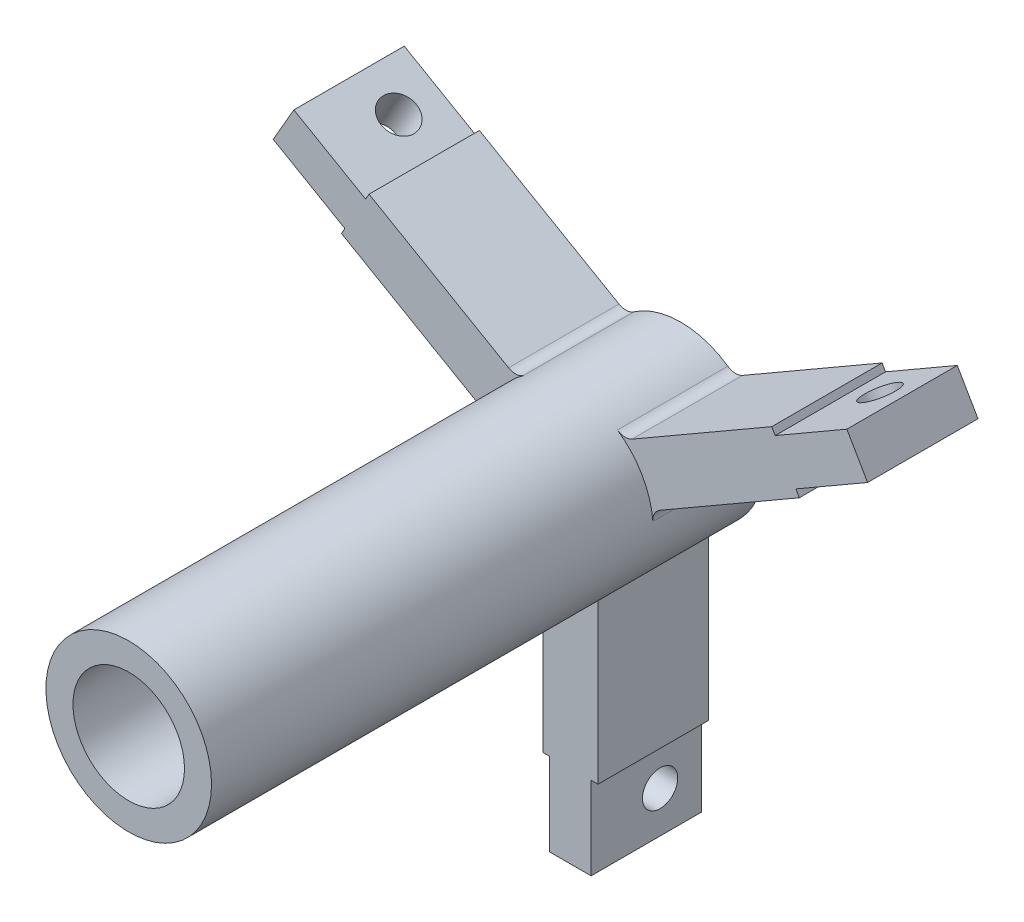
SolidWorks part; units mm, degrees
ref_plane "Plane1" through (0, 0, 0) normal (0, 0, 1) x (1, 0, 0)
ref_plane "Plane2" through (0, 0, 0) normal (0, 1, 0) x (1, 0, 0)
ref_plane "Plane3" through (0, 0, 0) normal (1, 0, 0) x (0, 0, -1)
sketch "Sketch1" plane through (0, 0, 0) normal (0, 0, 1) x (1, 0, 0)
  circle A0 centre (0, 0) radius 12.827
  circle A1 centre (0, 0) radius 19.05
  dimension "D1" = 25.654
  dimension "D2" = 38.1
extrude "Base-Extrude" add sketch "Sketch1" along normal blind 127
ref_plane "Plane4" through (0, -76.2, 0) normal (0, 1, 0) x (-1, 0, 0)
sketch "Sketch2" plane through (0, -76.2, 0) normal (0, 1, 0) x (-1, 0, 0)
  line L0 (0, 0) -> (0, 23.9235) construction
  line L1 (4.7625, 0) -> (-4.7625, 0)
  line L2 (-19.05, 0) -> (19.05, 0) construction
  line L3 (-4.7625, 0) -> (-4.7625, 25.4)
  line L4 (4.7625, 0) -> (4.7625, 25.4)
  line L5 (-4.7625, 25.4) -> (4.7625, 25.4)
  point P7 (0, 0)
  point P11 (0, 25.4)
  dimension "D1" = 25.4
  dimension "D2" = 9.525
extrude "Boss-Extrude1" add sketch "Sketch2" along normal up to surface (57.7549 mm away)
sketch "Sketch3" plane through (-4.7625, 0, 0) normal (-1, 0, 0) x (0, 0, 1)
  line L0 (0, -76.2) -> (25.4, -76.2) construction
  line L1 (0, -18.4451) -> (0, -76.2) construction
  circle A0 centre (9.525, -66.675) radius 4.064
  dimension "D1" = 8.128
  dimension "D2" = 9.525
  dimension "D3" = 9.525
extrude "Cut-Extrude1" cut sketch "Sketch3" against normal through all
pattern_circular "CirPattern1" count 3 every 120 about axis through (0, 0, 0) along (0, 0, 1) of "Boss-Extrude1"
sketch "Sketch6" plane through (-45.6189, 20.8388, 50.9368) normal (-0.5, -0.866, 0) x (0.866, -0.5, 0)
  line L0 (-26.2735, -50.9368) -> (-26.2735, -25.5368) construction
  line L1 (31.4814, -50.9368) -> (-26.2735, -50.9368) construction
  circle A0 centre (-16.7485, -41.4118) radius 4.064
  dimension "D1" = 8.128
  dimension "D2" = 9.525
  dimension "D3" = 9.525
extrude "Cut-Extrude2" cut sketch "Sketch6" against normal through all
sketch "Sketch7" plane through (34.3776, 14.3486, 49.693) normal (0.5, -0.866, 0) x (0.866, 0.5, 0)
  line L0 (39.2538, -49.693) -> (39.2538, -24.293) construction
  line L1 (-18.5011, -49.693) -> (39.2538, -49.693) construction
  circle A0 centre (29.7288, -40.168) radius 4.064
  dimension "D1" = 8.128
  dimension "D2" = 9.525
  dimension "D3" = 9.525
extrude "Cut-Extrude3" cut sketch "Sketch7" against normal through all
ref_plane "Plane5" through (0, 15.875, 0) normal (0, 1, 0) x (-1, 0, 0)
sketch "Sketch10" plane through (0, 15.875, 0) normal (0, 1, 0) x (-1, 0, 0)
  line L0 (0, 0) -> (0, 58.2673) construction
  line L2 (-12.827, 0) -> (12.827, 0) construction
  circle A0 centre (0, 38.1) radius 7.1501
  dimension "D1" = 14.3002
  dimension "D2" = 38.1
extrude "Cut-Extrude4" cut sketch "Sketch10" against normal blind 0.635
hole_wizard "Hole2" positions "Sketch11" profile "Sketch12" legacy
sketch "Sketch11" plane through (0, 15.24, 0) normal (0, 1, 0) x (-1, 0, 0)
  point P0 (0, 38.1)
sketch "Sketch12" plane through (0, 15.24, 38.1) normal (1, 0, 0) x (0, 0, 1)
  line L0 (0, 0) -> (0, 14.2338)
  line L1 (0, 14.2338) -> (2.5527, 12.7)
  line L2 (2.5527, 12.7) -> (2.5527, 9.525)
  line L3 (2.5527, 9.525) -> (3.175, 9.525)
  line L4 (3.175, 9.525) -> (3.175, 0.0025)
  line L5 (3.175, 0.0025) -> (3.175, 0)
  line L6 (3.175, 0) -> (0, 0)
ref_plane "Plane6" through (0, -57.15, 0) normal (0, 1, 0) x (-1, 0, 0)
sketch "Sketch13" plane through (0, -57.15, 0) normal (0, 1, 0) x (-1, 0, 0)
  line L0 (0, 25.4) -> (0, -5.2456) construction
  line L1 (-4.7625, 25.4) -> (4.7625, 25.4) construction
  line L2 (6.35, 25.4) -> (-6.35, 25.4)
  line L3 (-6.35, 25.4) -> (-6.35, 0)
  line L4 (6.35, 25.4) -> (6.35, 0)
  line L5 (-6.35, 0) -> (6.35, 0)
  point P8 (0, 25.4)
  point P9 (0, 25.4)
  point P12 (0, 0)
  dimension "D1" = 12.7
extrude "Boss-Extrude3" add sketch "Sketch13" along normal up to surface (39.1895 mm away)
pattern_circular "CirPattern2" count 3 every 120 about axis through (0, 0, 0) along (0, 0, 1) of "Boss-Extrude3"
fillet "Fillet1" radius 3.175 2 edges at (12.3793, 14.4795, 12.7) (-29.3488, 24.2769, 25.4)
fillet "Fillet2" radius 3.175 2 edges at (-18.7293, 3.481, 12.7) (-6.35, -17.9605, 12.7)
fillet "Fillet3" radius 3.175 2 edges at (18.7293, 3.481, 12.7) (6.35, -17.9605, 12.7)
